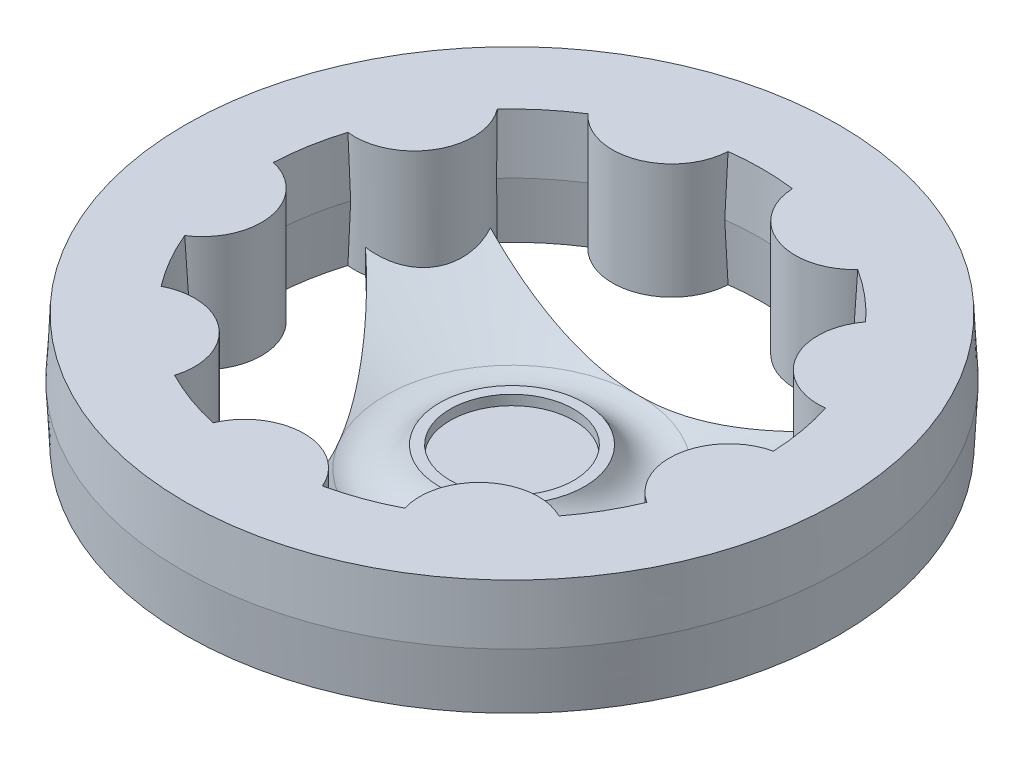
SolidWorks part; units mm, degrees
ref_plane "Front Plane" through (0, 0, 0) normal (0, 0, 1) x (1, 0, 0)
ref_plane "Top Plane" through (0, 0, 0) normal (0, 1, 0) x (1, 0, 0)
ref_plane "Right Plane" through (0, 0, 0) normal (1, 0, 0) x (0, 0, -1)
sketch "Sketch1" plane through (0, 0, 0) normal (0, 0, 1) x (1, 0, 0)
  line L0 (0, 0) -> (0, 45.9521) construction
  line L1 (0, 0) -> (16, 0)
  line L2 (16, 0) -> (16, -12.8)
  line L3 (16, -12.8) -> (17.6, -14.4)
  line L4 (17.6, -14.4) -> (17.6, -16)
  line L5 (17.6, -16) -> (16, -16)
  line L6 (16, -16) -> (16, -30.4)
  line L7 (15.4, -31) -> (3.6, -31)
  line L8 (0, -7.75) -> (0, 0)
  line L9 (0, -7.75) -> (3, -9.4821)
  line L10 (3, -9.4821) -> (3, -30.4)
  line L11 (3, -30.4) -> (3.6, -31)
  line L12 (16, -30.4) -> (15.4, -31)
  point P9 (16, -31)
  point P13 (3, -31)
  dimension "D1" = 45
  dimension "D2" = 32
  dimension "D3" = 1.6
  dimension "D4" = 15
  dimension "D5" = 31
  dimension "D6" = 6
  dimension "D7" = 60
  dimension "D8" = 23.25
  dimension "D9" = 0.6
  dimension "D10" = 0.6
  dimension "D11" = 0.6
  dimension "D12" = 0.6
revolve "Revolve1" add sketch "Sketch1" angle 360 about L0
sketch "Sketch2" plane through (0, 0, 0) normal (0, 0, 1) x (1, 0, 0)
  line L0 (16, 0) -> (-16, 0) construction
  line L1 (16, -12.8) -> (16, 0) construction
  line L2 (17.6, -14.4) -> (16, -12.8) construction
  line L3 (17.6, -16) -> (17.6, -14.4) construction
  line L4 (16, 0) -> (15, 0)
  line L5 (16, -12.8) -> (16, 0)
  line L6 (17.6, -14.4) -> (16, -12.8)
  line L7 (17.6, -16) -> (17.6, -14.4)
  line L8 (15, 0) -> (15, 2.4)
  line L9 (15, 2.4) -> (17.6, 2.4)
  line L10 (17.6, -16) -> (19.2, -16)
  line L11 (19.2, -16) -> (19.2, -15.9488)
  line L12 (22.4312, -11.1584) -> (56.7123, 2.6921)
  line L13 (64.2, 2) -> (64.2, 25.8)
  line L14 (64.2, 25.8) -> (75.8, 25.8)
  line L15 (75.8, 25.8) -> (75.8, 2)
  line L16 (75.8, 2) -> (79.2663, 2)
  line L17 (80, 2) -> (80, 30) construction
  line L18 (79.2663, 30) -> (60.7337, 30)
  line L19 (60, 30) -> (60, 2) construction
  line L20 (60, 2) -> (64.2, 2)
  line L21 (0, 0) -> (0, -29.5318) construction
  line L22 (-15.4, -31) -> (15.4, -31) construction
  line L23 (30.7445, -2.6226) -> (60, 9.1974)
  line L24 (80, 16) -> (79.2663, 30)
  line L25 (80, 16) -> (79.2663, 2)
  line L26 (80, 16) -> (60, 16) construction
  line L27 (60, 16) -> (60.7337, 30)
  line L28 (60, 16) -> (60, 9.1974)
  line L29 (17.6, 2.4) -> (17.6, -7.9333) construction
  line L30 (17.6, -7.9333) -> (30.7445, -2.6226) construction
  line L31 (56.7123, 2.6921) -> (60, 4.0204) construction
  arc A0 (60, 2) -> (56.7123, 2.6921) centre (57.8409, -0.1014) ccw
  arc A1 (17.6, 2.4) -> (30.7445, -2.6226) centre (26.8736, 6.9583) ccw
  arc A2 (22.4312, -11.1584) -> (19.2, -15.9488) centre (24.3667, -15.9488) ccw
  point P30 (19.2, -12.4639)
  dimension "D11" = 3.0129
  dimension "D15" = 10.3333
  dimension "D17" = 5.1667
  dimension "D18" = 3
  dimension "D1" = 1.6
  dimension "D2" = 20
  dimension "D3" = 28
  dimension "D4" = 4.2
  dimension "D5" = 4.2
  dimension "D6" = 80
  dimension "D7" = 61
  dimension "D8" = 4.2
  dimension "D9" = 10.3333
  dimension "D10" = 112
  dimension "D12" = 4.8
  dimension "D13" = 2.4
  dimension "D14" = 30
  dimension "D16" = 35.2
  dimension "D19" = 3
  dimension "D20" = 3
  dimension "D21" = 0
  dimension "D22" = 2.0204
revolve "Revolve2" add sketch "Sketch2" angle 360 about L21
sketch "Sketch3" plane through (0, 30, 0) normal (0, 1, 0) x (1, 0, 0)
  line L0 (0, 0) -> (0, 72.8617) construction
  line L1 (0, 0) -> (68.2353, 39.3957) construction
  line L2 (0, 0) -> (-63.5801, 36.708) construction
  line L3 (0, 0) -> (45.9627, 38.5673) construction
  line L4 (0, 0) -> (-45.9627, 38.5673) construction
  arc A2 (45.9627, 38.5673) -> (-45.9627, 38.5673) centre (0, 0) ccw
  arc A3 (-45.9627, 38.5673) -> (45.9627, 38.5673) centre (0, 169.6835) ccw
  circle A4 centre (0, 0) radius 30.7445 construction
  circle A5 centre (0, 0) radius 60 construction
  dimension "D1" = 120
  dimension "D2" = 10
extrude "Extrude1" cut sketch "Sketch3" against normal through all
pattern_circular "CirPattern1" count 3 over 360 about axis through (0, 0, 0) along (0, 1, 0) of "Extrude1"
ref_plane "Plane2" through (0, 16, 0) normal (0, 1, 0) x (-1, 0, 0)
draft "Draft5" type of draft neutral plane draft angle 3 neutral plane "Plane2" faces to draft 1 parameters "D1"=3
sketch "Sketch5" plane through (0, 30, 0) normal (0, 1, 0) x (1, 0, 0)
  line L0 (0, -60.7337) -> (0, -79.2663) construction
  circle A0 centre (0, 0) radius 60.7337 construction
  circle A1 centre (0, 0) radius 79.2663 construction
  arc A2 (13.2668, -59.267) -> (-13.2668, -59.267) centre (0, -64.8663) ccw
  arc A3 (-13.2668, -59.267) -> (13.2668, -59.267) centre (0, 0) ccw
  arc A4 (-13.2668, -59.267) -> (13.2668, -59.267) centre (0, -64.8663) ccw construction
  dimension "D1" = 14.4
extrude "Extrude2" add sketch "Sketch5" against normal up to surface (28 mm away)
pattern_circular "CirPattern2" count 9 over 360 about axis through (0, 0, 0) along (0, 1, 0) of "Extrude2"
sketch "Sketch6" plane through (0, 25.8, 0) normal (0, -1, 0) x (1, 0, 0)
  circle A1 centre (0, 64.8663) radius 14.4
  arc A2 (-13.2668, 59.267) -> (-9.6203, 54.1514) centre (0, 64.8663) ccw construction
extrude "Extrude3" add sketch "Sketch6" along normal up to surface (23.8 mm away)
sketch "Sketch9" plane through (0, 0, 0) normal (1, 0, 0) x (0, 0, -1)
  line L0 (-64.8663, 5.64) -> (-64.8663, -17.9981) construction
  line L1 (-64.8663, 2) -> (-64.8663, 30) construction
  line L2 (-58.8663, 2) -> (-58.8663, 5)
  line L3 (-59.267, 2) -> (-54.1514, 2) construction
  line L4 (-58.8663, 5) -> (-61.8663, 8)
  line L5 (-61.8663, 8) -> (-61.8663, 12)
  line L6 (-61.8663, 12) -> (-64.8663, 12)
  line L7 (-64.8663, 12) -> (-64.8663, 2)
  line L8 (-75.1231, 2) -> (-62.6051, 2) construction
  line L9 (-64.8663, 2) -> (-58.8663, 2)
  dimension "D1" = 45
  dimension "D2" = 12
  dimension "D3" = 3
  dimension "D4" = 3
  dimension "D5" = 4
revolve "Cut-Revolve1" cut sketch "Sketch9" angle 360 about L0
equation "\"D3@Sketch1\" = \"D2@Sketch1\"*.05"
equation "\"D8@Sketch1\" = \"D5@Sketch1\"*0.75"
equation "\"D9@Sketch1\" = \"D6@Sketch1\"*0.1"
equation "\"D12@Sketch1\" = \"D9@Sketch1\""
equation "\"D10@Sketch1\" = \"D9@Sketch1\""
equation "\"D11@Sketch1\" = \"D9@Sketch1\""
equation "\"D4@Sketch2\" = \"D3@Sketch2\"*0.15"
equation "\"D5@Sketch2\" = \"D4@Sketch2\""
equation "\"D8@Sketch2\" = \"D5@Sketch2\""
equation "\"D12@Sketch2\" = \"D6@Sketch2\"*0.06"
equation "\"D1@Sketch2\" = \"D3@Sketch1\""
equation "\"D15@Sketch2\" = \"D9@Sketch2\""
equation "\"D17@Sketch2\" = \"D9@Sketch2\"*0.5"
equation "\"D11@Sketch2\" = \"D22@Sketch2\""
